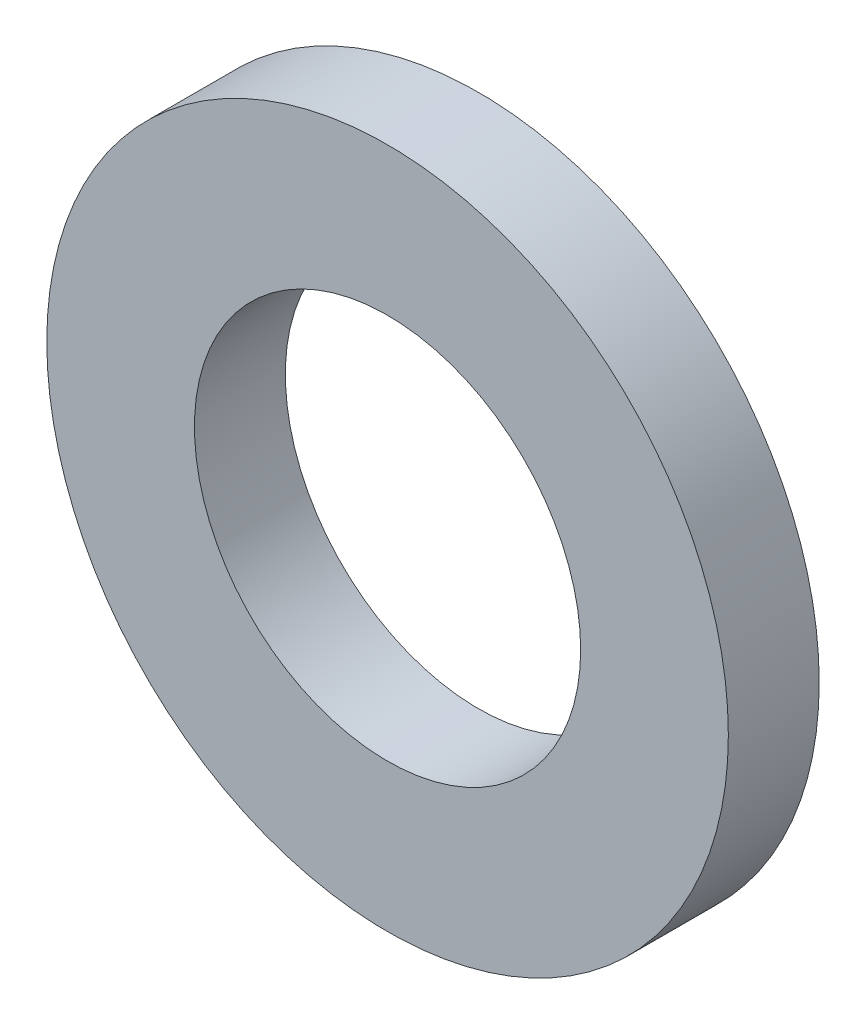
SolidWorks part; units mm, degrees
ref_plane "Front Plane" through (0, 0, 0) normal (0, 0, 1) x (1, 0, 0)
ref_plane "Top Plane" through (0, 0, 0) normal (0, 1, 0) x (1, 0, 0)
ref_plane "Right Plane" through (0, 0, 0) normal (1, 0, 0) x (0, 0, -1)
sketch "Sketch1" plane through (0, 0, 0) normal (0, 0, 1) x (1, 0, 0)
  circle A0 centre (0, 0) radius 3.81
  circle A1 centre (0, 0) radius 2.159
  dimension "D1" = 4.318
  dimension "D2" = 7.62
extrude "Boss-Extrude1" add sketch "Sketch1" along normal blind 1.016
